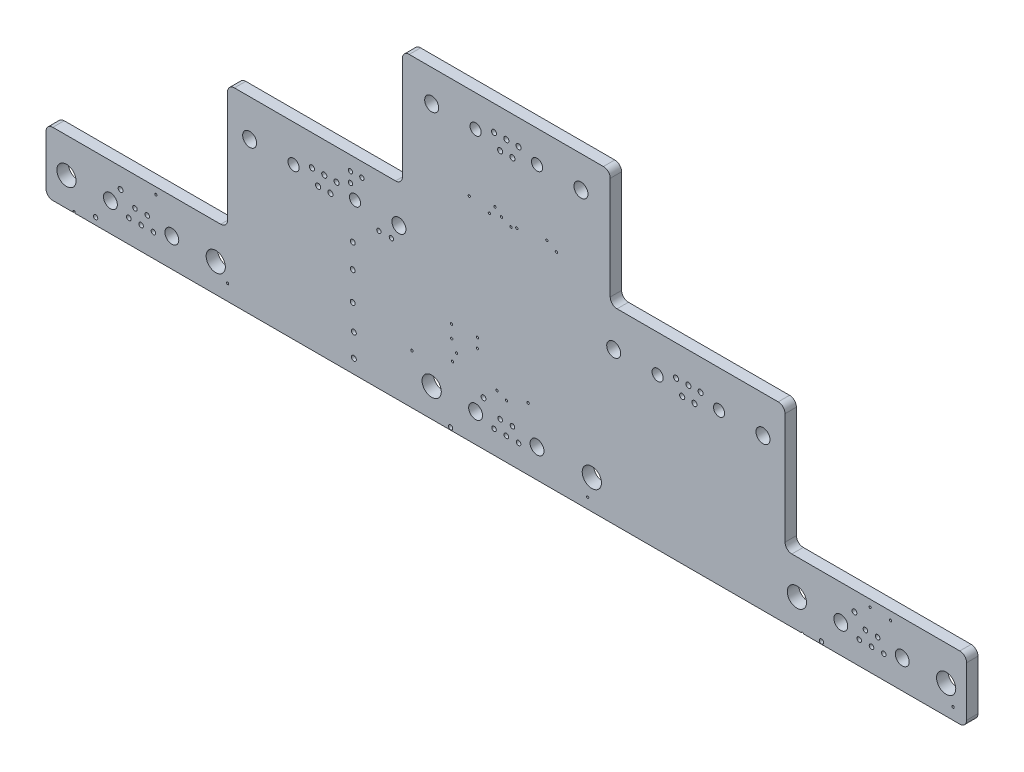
SolidWorks part; units mm, degrees
ref_plane "Front Plane" through (0, 0, 0) normal (0, 0, 1) x (1, 0, 0)
ref_plane "Top Plane" through (0, 0, 0) normal (0, 1, 0) x (1, 0, 0)
ref_plane "Right Plane" through (0, 0, 0) normal (1, 0, 0) x (0, 0, -1)
sketch "Model" plane through (0, 0, 0) normal (0, 0, 1) x (1, 0, 0)
  line L0 (0, 0) -> (208.28, 0)
  line L1 (208.28, 0) -> (208.28, 55.2196)
  line L2 (208.28, 55.2196) -> (167.386, 55.2196)
  line L3 (167.386, 55.2196) -> (167.386, 82.804)
  line L4 (167.386, 82.804) -> (40.6146, 82.804)
  line L5 (40.6146, 82.804) -> (40.6146, 55.0672)
  line L6 (40.6146, 55.0672) -> (0, 55.0672)
  line L7 (0, 55.0672) -> (0, 0)
  line L8 (161.4424, 41.1338) -> (128.1176, 41.1338) construction
  line L9 (142.0368, 42.5562) -> (147.5232, 42.5562) construction
  line L10 (144.78, 42.5562) -> (144.78, 39.4243) construction
  line L11 (104.14, 12.446) -> (104.14, 49.1593) construction
  line L12 (63.5, 42.5562) -> (63.5, 39.4243) construction
  line L13 (66.2432, 42.5562) -> (60.7568, 42.5562) construction
  line L14 (46.8376, 41.1338) -> (80.1624, 41.1338) construction
  line L15 (120.8024, 68.3118) -> (87.4776, 68.3118) construction
  line L16 (101.3968, 69.7342) -> (106.8832, 69.7342) construction
  line L17 (104.14, 69.7342) -> (104.14, 51.5528) construction
  circle A0 centre (110.998, 68.3118) radius 1.2446
  circle A1 centre (101.3968, 69.7342) radius 0.5715
  circle A2 centre (151.638, 41.1338) radius 1.2446
  circle A3 centre (142.0368, 42.5562) radius 0.5715
  circle A4 centre (144.78, 42.5562) radius 0.5715
  circle A5 centre (12.446, 8.89) radius 0.4826
  circle A6 centre (91.694, 7.874) radius 0.4826
  circle A7 centre (174.498, 7.874) radius 0.4826
  circle A8 centre (78.994, 52.324) radius 0.4826
  circle A9 centre (76.454, 52.324) radius 0.4826
  circle A10 centre (74.168, 52.324) radius 0.4826
  circle A11 centre (104.14, 69.7342) radius 0.5715
  circle A12 centre (106.8832, 69.7342) radius 0.5715
  circle A13 centre (75.692, 37.846) radius 0.4826
  circle A14 centre (78.486, 37.846) radius 0.4826
  circle A15 centre (69.342, 46.228) radius 0.4826
  circle A16 centre (69.342, 43.942) radius 0.4826
  circle A17 centre (71.882, 46.228) radius 0.4826
  circle A18 centre (102.7684, 66.8894) radius 0.5715
  circle A19 centre (105.5116, 66.8894) radius 0.5715
  circle A20 centre (147.5232, 42.5562) radius 0.5715
  circle A21 centre (143.4084, 39.7114) radius 0.5715
  circle A22 centre (198.882, 6.858) radius 0.4826
  circle A23 centre (201.168, 6.858) radius 0.4826
  circle A24 centre (146.1516, 39.7114) radius 0.5715
  circle A25 centre (137.922, 41.1338) radius 1.2446
  circle A26 centre (37.084, 6.604) radius 0.4826
  circle A27 centre (39.116, 6.604) radius 0.4826
  circle A28 centre (116.84, 6.858) radius 0.4826
  circle A29 centre (119.126, 6.858) radius 0.4826
  circle A30 centre (161.4424, 41.1338) radius 1.5621
  circle A31 centre (128.1176, 41.1338) radius 1.5621
  circle A32 centre (80.1624, 41.1338) radius 1.5621
  circle A33 centre (46.8376, 41.1338) radius 1.5621
  circle A34 centre (70.358, 41.1338) radius 1.2446
  circle A35 centre (62.1284, 39.7114) radius 0.5715
  circle A36 centre (64.8716, 39.7114) radius 0.5715
  circle A37 centre (60.7568, 42.5562) radius 0.5715
  circle A38 centre (63.5, 42.5562) radius 0.5715
  circle A39 centre (66.2432, 42.5562) radius 0.5715
  circle A40 centre (56.642, 41.1338) radius 1.2446
  circle A41 centre (97.282, 68.3118) radius 1.2446
  circle A42 centre (120.8024, 68.3118) radius 1.5621
  circle A43 centre (87.4776, 68.3118) radius 1.5621
  circle A89 centre (23.9776, 14.986) radius 0.508
  circle A90 centre (21.2344, 14.986) radius 0.508
  circle A91 centre (25.3492, 12.446) radius 0.508
  circle A92 centre (22.606, 12.446) radius 0.508
  circle A93 centre (19.8628, 12.446) radius 0.508
  circle A94 centre (29.464, 13.716) radius 1.5494
  circle A95 centre (15.748, 13.716) radius 1.5494
  circle A96 centre (39.2684, 13.716) radius 2.1463
  circle A97 centre (5.9436, 13.716) radius 2.1463
  circle A98 centre (105.5116, 14.986) radius 0.508
  circle A99 centre (102.7684, 14.986) radius 0.508
  circle A100 centre (106.8832, 12.446) radius 0.508
  circle A101 centre (104.14, 12.446) radius 0.508
  circle A102 centre (101.3968, 12.446) radius 0.508
  circle A103 centre (110.998, 13.716) radius 1.5494
  circle A104 centre (97.282, 13.716) radius 1.5494
  circle A105 centre (123.2334, 13.9558) radius 2.1463
  circle A106 centre (87.4776, 13.716) radius 2.1463
  circle A107 centre (187.0456, 14.986) radius 0.508
  circle A108 centre (184.3024, 14.986) radius 0.508
  circle A109 centre (188.4172, 12.446) radius 0.508
  circle A110 centre (185.674, 12.446) radius 0.508
  circle A111 centre (182.9308, 12.446) radius 0.508
  circle A112 centre (192.532, 13.716) radius 1.5494
  circle A113 centre (178.816, 13.716) radius 1.5494
  circle A114 centre (202.3364, 13.716) radius 2.1463
  circle A115 centre (169.0116, 13.716) radius 2.1463
  circle A119 centre (70.104, 15.494) radius 0.5461
  circle A120 centre (70.104, 10.414) radius 0.5461
  circle A121 centre (69.85, 32.766) radius 0.5461
  circle A127 centre (18.034, 17.018) radius 0.5461
  circle A128 centre (99.06, 17.272) radius 0.5461
  circle A129 centre (181.864, 17.272) radius 0.5461
  circle A130 centre (69.85, 21.082) radius 0.5461
  circle A131 centre (69.85, 27.432) radius 0.5461
  circle A133 centre (86.868, 7.0612) radius 0.254
  circle A135 centre (59.5884, 51.3334) radius 0.254
  circle A136 centre (67.945, 80.01) radius 0.254
  circle A137 centre (67.945, 77.8933) radius 0.254
  circle A138 centre (105.1983, 53.34) radius 0.254
  circle A139 centre (170.2308, 7.3152) radius 0.254
  circle A140 centre (65.4304, 77.216) radius 0.254
  circle A142 centre (115.316, 53.594) radius 0.254
  circle A143 centre (100.3554, 53.594) radius 0.254
  circle A147 centre (109.0168, 21.2344) radius 0.254
  circle A149 centre (60.6552, 50.0888) radius 0.254
  circle A150 centre (95.8596, 54.6608) radius 0.254
  circle A151 centre (101.6, 55.4567) radius 0.254
  circle A154 centre (185.3692, 22.7584) radius 0.254
  circle A155 centre (185.3692, 19.9136) radius 0.254
  circle A156 centre (113.1909, 54.7878) radius 0.254
  circle A157 centre (103.0478, 54.2036) radius 0.254
  circle A160 centre (102.0572, 20.1676) radius 0.254
  circle A164 centre (104.1908, 19.304) radius 0.254
  circle A165 centre (93.0402, 22.8854) radius 0.254
  circle A166 centre (83.058, 18.3896) radius 0.254
  circle A167 centre (7.6454, 7.5184) radius 0.254
  circle A170 centre (83.058, 18.3896) radius 0.254
  circle A172 centre (25.908, 19.9644) radius 0.254
  circle A177 centre (25.908, 19.9644) radius 0.254
  circle A182 centre (189.9158, 19.6596) radius 0.254
  circle A183 centre (91.948, 25.146) radius 0.254
  circle A184 centre (91.948, 25.146) radius 0.254
  circle A185 centre (97.6884, 28.2448) radius 0.254
  circle A186 centre (92.1258, 20.828) radius 0.254
  circle A188 centre (14.5542, 26.3652) radius 0.254
  circle A191 centre (91.9226, 27.9654) radius 0.254
  circle A192 centre (122.301, 9.652) radius 0.254
  circle A195 centre (41.91, 10.8204) radius 0.254
  circle A197 centre (54.5592, 54.3052) radius 0.254
  circle A198 centre (92.1258, 20.828) radius 0.254
  circle A199 centre (91.9226, 27.9654) radius 0.254
  circle A200 centre (203.8858, 9.906) radius 0.254
  circle A201 centre (97.6884, 26.1366) radius 0.254
  circle A202 centre (91.9226, 27.9654) radius 0.254
  circle A210 centre (137.6172, 53.4924) radius 0.254
  circle A212 centre (106.4683, 53.7633) radius 0.254
  point P0 (104.14, 68.3118)
  point P1 (104.2416, 68.3372)
  point P4 (144.78, 41.1338)
  point P5 (144.8816, 41.1592)
  point P87 (63.3984, 41.1592)
  point P124 (63.5, 41.1338)
  point P418 (88.138, 22.9108)
  point P419 (88.138, 20.7772)
  point P420 (90.678, 22.9108)
  point P421 (90.678, 20.7772)
  point P422 (77.724, 22.5552)
  point P423 (77.724, 21.1328)
  point P424 (83.058, 20.7772)
  point P425 (83.058, 22.9108)
  point P429 (56.896, 54.3052)
  point P430 (139.954, 55.6768)
  point P431 (139.954, 53.5432)
  point P433 (16.51, 26.3652)
  point P434 (99.314, 28.2448)
  point P435 (99.314, 26.1112)
  point P438 (9.652, 9.7028)
  point P439 (9.652, 7.5692)
  point P440 (88.9, 9.1948)
  point P441 (88.9, 7.0612)
  point P442 (171.958, 9.4488)
  point P443 (171.958, 7.3152)
  point P446 (165.1508, 63.5)
  point P454 (43.7388, 8.89)
  point P455 (41.6052, 8.89)
  point P456 (123.7488, 8.128)
  point P457 (121.6152, 8.128)
  point P458 (205.5368, 8.382)
  point P459 (203.4032, 8.382)
  point P460 (85.598, 22.9108)
  point P461 (85.598, 20.7772)
  point P462 (87.884, 29.845)
  point P463 (87.884, 28.067)
  point P464 (90.424, 28.9814)
  point P470 (12.446, 8.89)
  point P471 (91.694, 7.874)
  point P472 (174.498, 7.874)
  point P474 (76.454, 52.324)
  point P475 (74.168, 52.324)
  point P478 (75.692, 37.846)
  point P480 (69.342, 46.228)
  point P481 (69.342, 43.942)
  point P482 (71.882, 46.228)
  point P487 (198.882, 6.858)
  point P488 (201.168, 6.858)
  point P491 (37.084, 6.604)
  point P492 (39.116, 6.604)
  point P493 (116.84, 6.858)
  point P494 (119.126, 6.858)
  point P497 (70.6628, 52.4002)
  point P499 (70.6628, 48.1838)
  point P501 (77.216, 54.7624)
  point P504 (70.6628, 37.7698)
  point P506 (70.6628, 41.9862)
  point P507 (75.184, 35.4076)
  point P508 (72.9234, 44.3484)
  point P521 (89.9668, 25.146)
  point P522 (87.8332, 25.146)
  point P568 (23.9776, 14.986)
  point P569 (21.2344, 14.986)
  point P570 (25.3492, 12.446)
  point P571 (22.606, 12.446)
  point P572 (19.8628, 12.446)
  point P573 (29.464, 13.716)
  point P574 (15.748, 13.716)
  point P575 (39.2684, 13.716)
  point P576 (5.9436, 13.716)
  point P577 (105.5116, 14.986)
  point P578 (102.7684, 14.986)
  point P579 (106.8832, 12.446)
  point P580 (104.14, 12.446)
  point P581 (101.3968, 12.446)
  point P582 (110.998, 13.716)
  point P583 (97.282, 13.716)
  point P584 (120.8024, 13.716)
  point P585 (87.4776, 13.716)
  point P586 (187.0456, 14.986)
  point P587 (184.3024, 14.986)
  point P588 (188.4172, 12.446)
  point P589 (185.674, 12.446)
  point P590 (182.9308, 12.446)
  point P591 (192.532, 13.716)
  point P592 (178.816, 13.716)
  point P593 (202.3364, 13.716)
  point P594 (169.0116, 13.716)
  point P625 (24.9428, 4.2926)
  point P626 (24.9428, 8.9154)
  point P627 (18.034, 6.604)
  point P628 (104.2924, 4.191)
  point P629 (104.2924, 8.8138)
  point P630 (97.3836, 6.5024)
  point P631 (187.0964, 4.445)
  point P632 (187.0964, 9.0678)
  point P633 (180.1876, 6.7564)
  point P634 (38.1508, 4.2926)
  point P635 (38.1508, 8.9154)
  point P636 (31.242, 6.604)
  point P637 (117.7544, 4.445)
  point P638 (117.7544, 9.0678)
  point P639 (110.8456, 6.7564)
  point P640 (200.0504, 4.445)
  point P641 (200.0504, 9.0678)
  point P642 (193.1416, 6.7564)
  point P655 (80.264, 22.9108)
  point P656 (80.264, 20.7772)
  point P681 (21.2852, 18.034)
  point P682 (23.4188, 18.034)
  point P683 (102.0572, 17.78)
  point P684 (104.1908, 17.78)
  point P685 (185.3692, 17.78)
  point P686 (187.5028, 17.78)
  point P689 (27.9908, 18.034)
  point P690 (25.8572, 18.034)
  point P691 (109.0168, 17.78)
  point P692 (106.8832, 17.78)
  point P693 (192.0748, 17.78)
  point P694 (189.9412, 17.78)
  point P698 (70.104, 15.494)
  point P699 (70.104, 10.414)
  point P700 (69.85, 32.766)
  point P706 (18.034, 17.018)
  point P707 (99.06, 17.272)
  point P708 (181.864, 17.272)
  point P709 (69.85, 21.082)
  point P710 (69.85, 27.432)
  point P711 (80.772, 25.2984)
  point P712 (83.058, 25.2984)
  point P713 (85.344, 25.2984)
  point P740 (59.436, 55.626)
  point P741 (59.436, 54.6862)
  point P742 (61.976, 54.6862)
  point P743 (61.976, 55.626)
  point P751 (143.002, 55.8038)
  point P752 (143.002, 54.864)
  point P753 (143.002, 53.9242)
  point P754 (145.542, 53.9242)
  point P755 (145.542, 54.864)
  point P756 (145.542, 55.8038)
  point P771 (19.304, 26.7462)
  point P772 (21.844, 26.7462)
  point P775 (101.854, 28.3718)
  point P776 (101.854, 27.432)
  point P777 (101.854, 26.4922)
  point P778 (104.394, 26.4922)
  point P779 (104.394, 27.432)
  point P780 (104.394, 28.3718)
  point P784 (122.2502, 29.972)
  point P785 (123.19, 29.972)
  point P786 (124.1298, 29.972)
  point P799 (12.8778, 5.08)
  point P800 (11.938, 5.08)
  point P801 (10.9982, 5.08)
  point P802 (10.9982, 2.54)
  point P803 (11.938, 2.54)
  point P804 (12.8778, 2.54)
  point P805 (43.1038, 6.35)
  point P806 (42.164, 6.35)
  point P807 (41.2242, 6.35)
  point P808 (41.2242, 3.81)
  point P809 (42.164, 3.81)
  point P810 (43.1038, 3.81)
  point P811 (91.8718, 4.572)
  point P812 (90.932, 4.572)
  point P813 (89.9922, 4.572)
  point P814 (89.9922, 2.032)
  point P815 (90.932, 2.032)
  point P816 (91.8718, 2.032)
  point P817 (123.1138, 5.842)
  point P818 (122.174, 5.842)
  point P819 (121.2342, 5.842)
  point P820 (121.2342, 3.302)
  point P821 (122.174, 3.302)
  point P822 (123.1138, 3.302)
  point P823 (174.6758, 4.826)
  point P824 (173.736, 4.826)
  point P825 (172.7962, 4.826)
  point P826 (172.7962, 2.286)
  point P827 (173.736, 2.286)
  point P828 (174.6758, 2.286)
  point P829 (204.9018, 6.096)
  point P830 (203.962, 6.096)
  point P831 (203.0222, 6.096)
  point P832 (203.0222, 3.556)
  point P833 (203.962, 3.556)
  point P834 (204.9018, 3.556)
  point P836 (86.868, 7.0612)
  point P838 (59.5884, 51.3334)
  point P839 (67.945, 80.01)
  point P840 (67.945, 77.8933)
  point P842 (170.2308, 7.3152)
  point P843 (65.4304, 77.216)
  point P845 (115.316, 53.594)
  point P846 (100.3554, 53.594)
  point P850 (109.0168, 21.2344)
  point P852 (60.6552, 50.0888)
  point P853 (95.8596, 54.6608)
  point P854 (101.6, 55.4567)
  point P857 (185.3692, 22.7584)
  point P858 (185.3692, 19.9136)
  point P859 (113.1909, 54.7878)
  point P860 (103.0478, 54.2036)
  point P863 (102.0572, 20.1676)
  point P867 (104.1908, 19.304)
  point P868 (93.0402, 22.8854)
  point P869 (83.058, 18.3896)
  point P870 (7.6454, 7.5184)
  point P873 (83.058, 18.3896)
  point P875 (25.908, 19.9644)
  point P880 (25.908, 19.9644)
  point P885 (189.9158, 19.6596)
  point P886 (91.948, 25.146)
  point P887 (91.948, 25.146)
  point P888 (97.6884, 28.2448)
  point P889 (92.1258, 20.828)
  point P891 (14.5542, 26.3652)
  point P894 (91.9226, 27.9654)
  point P895 (122.301, 9.652)
  point P898 (41.91, 10.8204)
  point P900 (54.5592, 54.3052)
  point P901 (92.1258, 20.828)
  point P902 (91.9226, 27.9654)
  point P903 (203.8858, 9.906)
  point P904 (97.6884, 26.1366)
  point P905 (91.9226, 27.9654)
  point P913 (137.6172, 53.4924)
  point P915 (106.4683, 53.7633)
  dimension "D1" = 1.143
  dimension "D7" = 2.4892
  dimension "D8" = 3.1242
  dimension "D15" = 1.143
  dimension "D21" = 2.4892
  dimension "D22" = 3.1242
  dimension "D2" = 1.3716
  dimension "D3" = 1.4224
  dimension "D4" = 2.7432
  dimension "D5" = 2.7432
  dimension "D6" = 1.4224
  dimension "D9" = 6.858
  dimension "D10" = 16.6624
  dimension "D11" = 0.0254
  dimension "D12" = 0.1016
  dimension "D13" = 27.178
  dimension "D14" = 40.64
  dimension "D16" = 1.3716
  dimension "D17" = 1.4224
  dimension "D18" = 2.7432
  dimension "D19" = 2.7432
  dimension "D20" = 1.4224
  dimension "D23" = 6.858
  dimension "D24" = 16.6624
  dimension "D25" = 0.0254
  dimension "D26" = 0.1016
  dimension "D27" = 27.178
extrude "Boss-Extrude1" add sketch "Model" along normal blind 2.54
sketch "Sketch2" plane through (0, 0, 2.54) normal (0, 0, 1) x (1, 0, 0)
  line L1 (35.1134, 90.568) -> (180.5812, 90.568)
  line L2 (35.1134, 90.568) -> (35.1134, 73.2672)
  line L3 (35.1134, 73.2672) -> (180.5812, 73.2672)
  line L4 (180.5812, 90.568) -> (180.5812, 73.2672)
extrude "Cut-Extrude1" [suppressed] cut sketch "Sketch2" against normal through all
sketch "Sketch3" plane through (0, 0, 0) normal (0, 0, -1) x (-1, 0, 0)
  line L0 (-80.938, 75.3567) -> (-80.938, 49.3694)
  line L1 (-80.938, 49.3694) -> (-41.91, 49.3694)
  line L2 (-227.337, 108.4878) -> (11.6293, 108.4878)
  line L3 (-227.337, 108.4878) -> (-227.337, -10.9954)
  line L4 (-227.337, -10.9954) -> (11.6293, -10.9954)
  line L5 (-41.91, 49.3694) -> (-41.91, 21.4792)
  line L6 (-41.91, 21.4792) -> (-1.3716, 21.4792)
  line L7 (11.6293, 108.4878) -> (11.6293, -10.9954)
  line L8 (-127.342, 49.3694) -> (-166.37, 49.3694)
  line L9 (-127.342, 75.3567) -> (-127.342, 49.3694)
  line L10 (-104.14, 112.2145) -> (-104.14, -18.5184) construction
  line L12 (-166.37, 21.4792) -> (-206.9084, 21.4792)
  line L18 (-203.5024, 7.3203) -> (-4.7776, 7.3203)
  line L21 (-1.3716, 21.4792) -> (-1.3716, 7.3203)
  line L22 (-1.3716, 7.3203) -> (-4.7776, 7.3203)
  line L25 (-206.9084, 7.3203) -> (-203.5024, 7.3203)
  line L26 (-206.9084, 21.4792) -> (-206.9084, 7.3203)
  line L30 (-127.342, 75.3567) -> (-80.938, 75.3567)
  line L36 (-166.37, 49.3694) -> (-166.37, 21.4792)
extrude "Cut-Extrude2" cut sketch "Sketch3" against normal through all
fillet "Fillet1" radius 1.524 12 edges at (166.37, 21.4792, 1.27) (1.3716, 7.3203, 1.27) (206.9084, 7.3203, 1.27) (206.9084, 21.4792, 1.27) (1.3716, 21.4792, 1.27) (41.91, 21.4792, 1.27) (41.91, 49.3694, 1.27) (80.938, 49.3694, 1.27) (80.938, 75.3567, 1.27) (127.342, 75.3567, 1.27) (127.342, 49.3694, 1.27) (166.37, 49.3694, 1.27)
